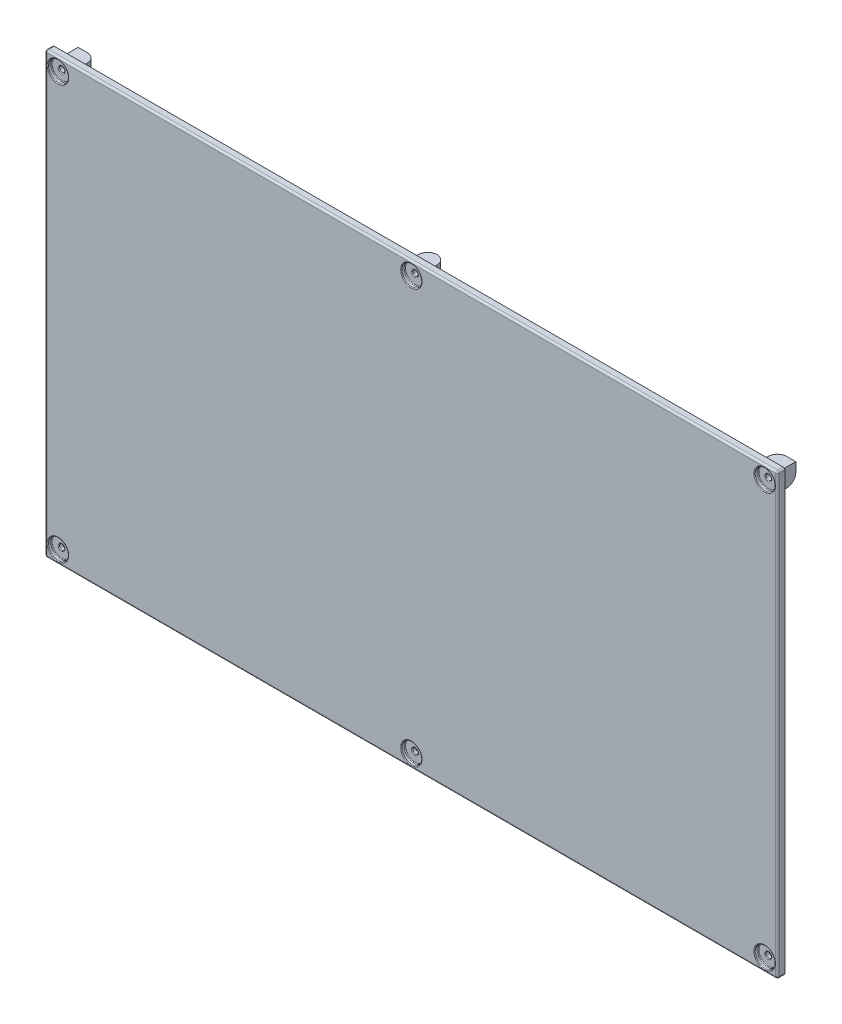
SolidWorks part; units mm, degrees
ref_plane "Ebene vorne" through (0, 0, 0) normal (0, 0, 1) x (1, 0, 0)
ref_plane "Ebene oben" through (0, 0, 0) normal (0, 1, 0) x (1, 0, 0)
ref_plane "Ebene rechts" through (0, 0, 0) normal (1, 0, 0) x (0, 0, -1)
sketch "Skizze1" plane through (0, 0, 0) normal (0, 0, 1) x (1, 0, 0)
  line L1 (0, 0) -> (200, 0)
  line L2 (0, 0) -> (0, 120)
  line L3 (0, 120) -> (200, 120)
  line L4 (200, 0) -> (200, 120)
  dimension "D1" = 200
  dimension "D2" = 120
extrude "Aufsatz-Linear austragen1" add sketch "Skizze1" along normal blind 2
sketch "Skizze2" plane through (0, 0, 2) normal (0, 0, 1) x (1, 0, 0)
  line L0 (0, 120) -> (0, 0) construction
  line L1 (200, 120) -> (0, 120) construction
  line L2 (100, 120) -> (100, 0) construction
  line L3 (0, 0) -> (200, 0) construction
  line L4 (51.75, 120) -> (51.75, 0) construction
  line L5 (0, 60) -> (200, 60) construction
  line L6 (200, 0) -> (200, 120) construction
  circle A0 centre (3.5, 116.5) radius 0.75
  circle A1 centre (100, 116.5) radius 0.75
  circle A2 centre (196.5, 116.5) radius 0.75
  circle A3 centre (196.5, 3.5) radius 0.75
  circle A4 centre (100, 3.5) radius 0.75
  circle A5 centre (3.5, 3.5) radius 0.75
  dimension "D1" = 1.5
  dimension "D2" = 3.5
  dimension "D3" = 3.5
  dimension "D4" = 48.25
extrude "Schnitt-Linear austragen1" cut sketch "Skizze2" against normal blind 7
sketch "Skizze3" plane through (0, 0, 2) normal (0, 0, 1) x (1, 0, 0)
  line L0 (100, 120) -> (100, 0) construction
  line L1 (200, 120) -> (0, 120) construction
  line L2 (0, 0) -> (200, 0) construction
  line L3 (0, 60) -> (200, 60) construction
  line L4 (0, 120) -> (0, 0) construction
  line L5 (200, 0) -> (200, 120) construction
  line L6 (51.75, 120) -> (51.75, 0) construction
  circle A0 centre (3.5, 116.5) radius 2.75
  circle A1 centre (3.5, 116.5) radius 0.75 construction
  circle A2 centre (100, 116.5) radius 2.75
  circle A3 centre (196.5, 116.5) radius 2.75
  circle A4 centre (196.5, 3.5) radius 2.75
  circle A5 centre (100, 3.5) radius 2.75
  circle A6 centre (3.5, 3.5) radius 2.75
  dimension "D1" = 2
  dimension "D2" = 48.25
extrude "Schnitt-Linear austragen2" cut sketch "Skizze3" against normal blind 1
fillet "Verrundung1" radius 0.2 18 edges at (4.25, 116.5, 1) (6.25, 116.5, 1) (6.25, 116.5, 2) (2.75, 3.5, 1) (0.75, 3.5, 1) (0.75, 3.5, 2) (102.75, 3.5, 2) (102.75, 3.5, 1) (100.75, 3.5, 1) (197.25, 3.5, 1) (199.25, 3.5, 1) (199.25, 3.5, 2) (193.75, 116.5, 2) (193.75, 116.5, 1) (195.75, 116.5, 1) (97.25, 116.5, 2) (97.25, 116.5, 1) (99.25, 116.5, 1)
fillet "Verrundung2" radius 0.5 8 edges at (0, 120, 1) (200, 120, 1) (200, 0, 1) (0, 0, 1) (200, 60, 2) (100, 0, 2) (100, 120, 2) (0, 60, 2)
sketch "Skizze5" plane through (0, 0, 0) normal (0, 0, -1) x (-1, 0, 0)
  line L0 (0, 119.5) -> (0, 0.5) construction
  line L1 (-7, 118) -> (-2, 118)
  line L2 (-7, 118) -> (-7, 113)
  line L3 (-7, 113) -> (-2, 113)
  line L4 (-2, 118) -> (-2, 113)
  line L5 (-199.5, 120) -> (-0.5, 120) construction
  line L6 (-100, 120) -> (-100, 0) construction
  line L7 (-0.5, 0) -> (-199.5, 0) construction
  line L8 (-147.75, 120) -> (-147.75, 0) construction
  line L9 (-193, 113) -> (-198, 113)
  line L10 (-198, 118) -> (-198, 113)
  line L11 (-193, 118) -> (-198, 118)
  line L12 (-193, 118) -> (-193, 113)
  line L13 (-102.5, 118) -> (-102.5, 113)
  line L14 (-102.5, 118) -> (-97.5, 118)
  line L15 (-97.5, 118) -> (-97.5, 113)
  line L16 (-102.5, 113) -> (-97.5, 113)
  dimension "D1" = 2
  dimension "D2" = 2
  dimension "D3" = 5
  dimension "D4" = 5
  dimension "D5" = 47.75
extrude "Aufsatz-Linear austragen2" add sketch "Skizze5" along normal blind 5
fillet "Verrundung3" radius 2.5 12 edges at (195.5, 113, 0) (193, 115.5, 0) (195.5, 113, -5) (193, 115.5, -5) (4.5, 113, -5) (4.5, 113, 0) (7, 115.5, 0) (7, 115.5, -5) (102.5, 115.5, 0) (102.5, 115.5, -5) (97.5, 115.5, 0) (97.5, 115.5, -5)
sketch "Skizze6" plane through (0, 0, 0) normal (0, 0, 1) x (1, 0, 0)
  circle A0 centre (3.5, 116.5) radius 0.75
  dimension "D1" = 1.5
extrude "Schnitt-Linear austragen3" cut sketch "Skizze6" against normal blind 5
sketch "Skizze7" plane through (0, 0, 0) normal (0, 0, 1) x (1, 0, 0)
  circle A0 centre (100, 116.5) radius 0.75
  dimension "D1" = 1.5
extrude "Schnitt-Linear austragen4" cut sketch "Skizze7" against normal blind 5
sketch "Skizze8" plane through (0, 0, 0) normal (0, 0, 1) x (1, 0, 0)
  circle A0 centre (196.5, 116.5) radius 0.75
  dimension "D1" = 1.5
extrude "Schnitt-Linear austragen5" cut sketch "Skizze8" against normal blind 5
